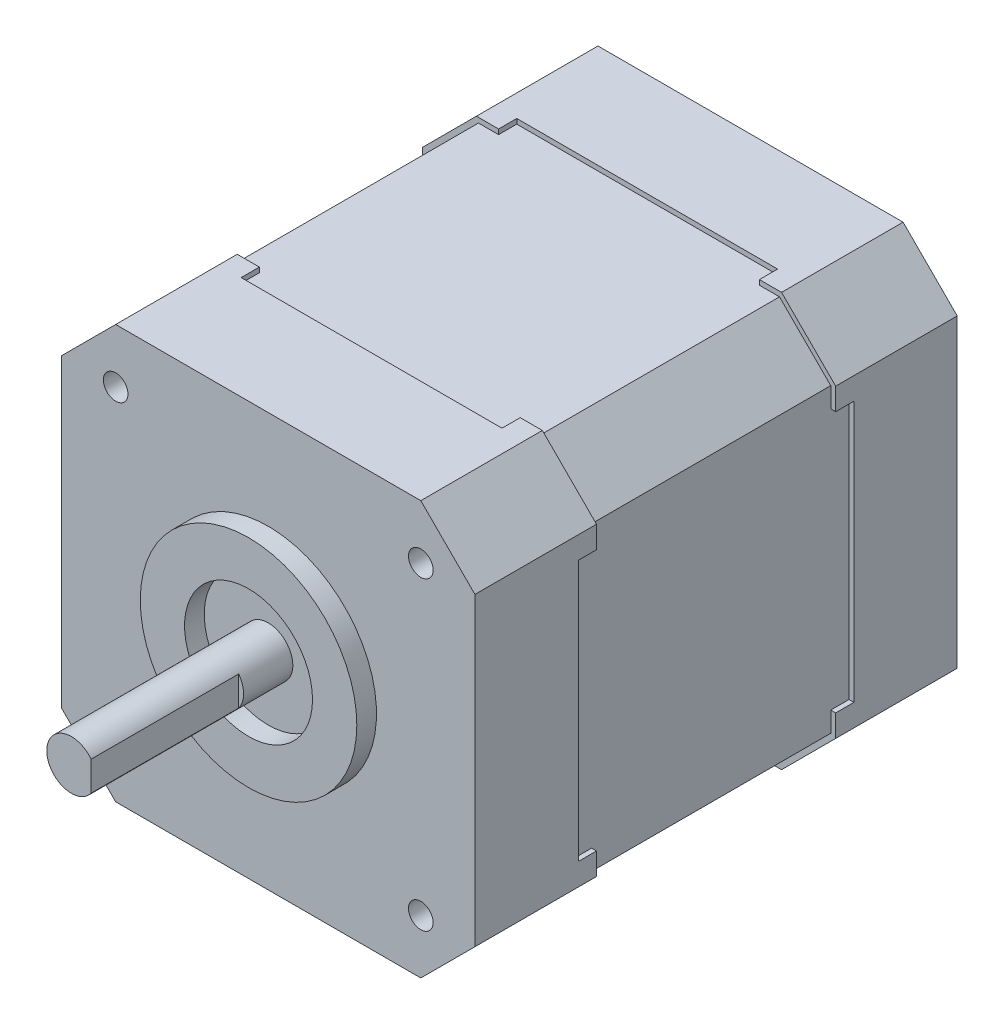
SolidWorks part; units mm, degrees
ref_plane "前基準面" through (0, 0, 0) normal (0, 0, 1) x (1, 0, 0)
ref_plane "上基準面" through (0, 0, 0) normal (0, 1, 0) x (1, 0, 0)
ref_plane "右基準面" through (0, 0, 0) normal (1, 0, 0) x (0, 0, -1)
sketch "草圖1" plane through (0, 0, 0) normal (0, 0, 1) x (1, 0, 0)
  line L0 (-21, 15.5) -> (-15.5, 21)
  line L1 (-15.5, 21) -> (15.5, 21)
  line L2 (-21, 15.5) -> (-21, -15.5)
  line L3 (-15.5, -21) -> (15.5, -21)
  line L4 (21, 15.5) -> (21, -15.5)
  line L5 (-18.25, 18.25) -> (18.25, -18.25) construction
  line L6 (-18.25, -18.25) -> (18.25, 18.25) construction
  line L7 (-21, -15.5) -> (-15.5, -21)
  line L8 (15.5, -21) -> (21, -15.5)
  line L9 (15.5, 21) -> (21, 15.5)
  point P0 (0, 0)
  dimension "D1" = 42
  dimension "D2" = 21
  dimension "D3" = 42
  dimension "D4" = 21
  dimension "D5" = 5.5
  dimension "D6" = 5.5
  dimension "D7" = 31
  dimension "D8" = 5.5
  dimension "D9" = 31
  dimension "D10" = 5.5
  dimension "D11" = 31
  dimension "D12" = 31
extrude "填料-伸長1" add sketch "草圖1" against normal blind 49
sketch "草圖2" plane through (0, 0, 0) normal (0, 0, 1) x (1, 0, 0)
  circle A0 centre (0, 0) radius 11
  circle A1 centre (0, 0) radius 6.5
  dimension "D1" = 22
  dimension "D2" = 13
extrude "填料-伸長2" add sketch "草圖2" along normal blind 2
sketch "草圖3" plane through (0, 0, 0) normal (0, 0, 1) x (1, 0, 0)
  circle A0 centre (0, 0) radius 2.5
  dimension "D1" = 5
extrude "填料-伸長3" add sketch "草圖3" along normal blind 20
sketch "草圖4" plane through (0, 0, 20) normal (0, 0, 1) x (1, 0, 0)
  line L0 (2, 1.5) -> (2, -1.5)
  arc A0 (2, -1.5) -> (2, 1.5) centre (0, 0) ccw
  dimension "D1" = 5
  dimension "D3" = 2
extrude "除料-伸長1" cut sketch "草圖4" against normal blind 15
ref_plane "平面1" through (0, 0, -12.35) normal (0, 0, 1) x (1, 0, 0)
sketch "草圖5" plane through (0, 0, -12.35) normal (0, 0, 1) x (1, 0, 0)
  line L0 (15.5, 21) -> (-15.5, 21) construction
  line L1 (21, 15.5) -> (15.5, 21) construction
  line L2 (21, -15.5) -> (21, 15.5) construction
  line L3 (15.5, -21) -> (21, -15.5) construction
  line L4 (-15.5, -21) -> (15.5, -21) construction
  line L5 (-21, -15.5) -> (-15.5, -21) construction
  line L6 (-21, 15.5) -> (-21, -15.5) construction
  line L7 (-15.5, 21) -> (-21, 15.5) construction
  line L8 (15.5, 21) -> (-15.5, 21)
  line L9 (21, 15.5) -> (15.5, 21)
  line L10 (21, -15.5) -> (21, 15.5)
  line L11 (15.5, -21) -> (21, -15.5)
  line L12 (-15.5, -21) -> (15.5, -21)
  line L13 (-21, -15.5) -> (-15.5, -21)
  line L14 (-21, 15.5) -> (-21, -15.5)
  line L15 (-15.5, 21) -> (-21, 15.5)
sketch "草圖6" plane through (0, 0, 0) normal (1, 0, 0) x (0, 0, -1)
  line L0 (12.35, 21) -> (12.35, 15.5) construction
  line L1 (12.35, 21) -> (36.65, 21)
  line L2 (12.35, 21) -> (12.35, 20.5)
  line L3 (12.35, 20.5) -> (36.65, 20.5)
  line L4 (36.65, 21) -> (36.65, 20.5)
  line L5 (49, 21) -> (0, 21) construction
  line L7 (49, 15.5) -> (49, 21) construction
  dimension "D1" = 0.5
  dimension "D2" = 12.35
sweep "除料-掃出1" cut profiles "草圖6" path "草圖5"
sketch "草圖7" plane through (0, 21, 0) normal (0, 1, 0) x (1, 0, 0)
  line L0 (15.5, 0) -> (-15.5, 0) construction
  line L1 (-13.25, 38.5) -> (13.25, 38.5)
  line L2 (-13.25, 38.5) -> (-13.25, 10.5)
  line L3 (-13.25, 10.5) -> (13.25, 10.5)
  line L4 (13.25, 38.5) -> (13.25, 10.5)
  line L6 (15.5, 49) -> (-15.5, 49) construction
  dimension "D1" = 10.5
  dimension "D2" = 26.5
  dimension "D3" = 13.25
  dimension "D4" = 10.5
extrude "除料-伸長2" cut sketch "草圖7" against normal up to surface (0.5 mm away)
sketch "草圖8" plane through (21, 0, 0) normal (1, 0, 0) x (0, 0, -1)
  line L0 (0, 11) -> (0, -11) construction
  line L1 (10.5, 13.25) -> (38.5, 13.25)
  line L2 (10.5, 13.25) -> (10.5, -13.25)
  line L3 (10.5, -13.25) -> (38.5, -13.25)
  line L4 (38.5, 13.25) -> (38.5, -13.25)
  line L5 (49, -15.5) -> (49, 15.5) construction
  dimension "D1" = 26.5
  dimension "D2" = 10.5
  dimension "D3" = 10.5
  dimension "D4" = 13.25
extrude "除料-伸長3" cut sketch "草圖8" against normal up to surface (0.5 mm away)
sketch "草圖9" plane through (0, -21, 0) normal (0, -1, 0) x (1, 0, 0)
  line L0 (-15.5, 0) -> (15.5, 0) construction
  line L1 (-13.25, -10.5) -> (13.25, -10.5)
  line L2 (-13.25, -10.5) -> (-13.25, -38.5)
  line L3 (-13.25, -38.5) -> (13.25, -38.5)
  line L4 (13.25, -10.5) -> (13.25, -38.5)
  line L5 (-15.5, -49) -> (15.5, -49) construction
  dimension "D1" = 13.25
  dimension "D2" = 26.5
  dimension "D3" = 10.5
  dimension "D4" = 10.5
extrude "除料-伸長4" cut sketch "草圖9" against normal up to surface (0.5 mm away)
sketch "草圖10" plane through (-21, 0, 0) normal (-1, 0, 0) x (0, 0, 1)
  line L0 (0, 15.5) -> (0, -15.5) construction
  line L1 (-38.5, 13.25) -> (-10.5, 13.25)
  line L2 (-38.5, 13.25) -> (-38.5, -13.25)
  line L3 (-38.5, -13.25) -> (-10.5, -13.25)
  line L4 (-10.5, 13.25) -> (-10.5, -13.25)
  line L5 (-49, 15.5) -> (-49, -15.5) construction
  dimension "D1" = 26.5
  dimension "D2" = 13.25
  dimension "D3" = 10.5
  dimension "D4" = 10.5
extrude "除料-伸長5" cut sketch "草圖10" against normal up to surface (0.5 mm away)
hole_wizard "M3 螺紋孔1" positions "草圖12" profile "草圖11" tap size "M3" standard "ISO"
sketch "草圖12" plane through (0, 0, 0) normal (0, 0, 1) x (1, 0, 0)
  point P1 (-15.5, 15.5)
  point P3 (15.5, 15.5)
  point P5 (15.5, -15.5)
  point P7 (-15.5, -15.5)
  dimension "D1" = 15.5
  dimension "D2" = 15.5
  dimension "D3" = 31
  dimension "D4" = 15.5
  dimension "D5" = 31
  dimension "D6" = 15.5
  dimension "D7" = 31
  dimension "D8" = 31
sketch "草圖11" plane through (-15.5, 15.5, 0) normal (1, 0, 0) x (0, -1, 0)
  line L0 (0, 0) -> (0, 5.2511)
  line L1 (0, 5.2511) -> (1.25, 4.5)
  line L2 (1.25, 4.5) -> (1.25, 0)
  line L5 (1.25, 0) -> (0, 0)
  line L10 (0, 5.2511) -> (-1.25, 4.5) construction
  line L11 (0, -6.35) -> (0, 107.95) construction
  dimension "螺孔鑽直徑" = 2.5
  dimension "螺孔鑽深度" = 4.5
  dimension "導頭角度" = 118
